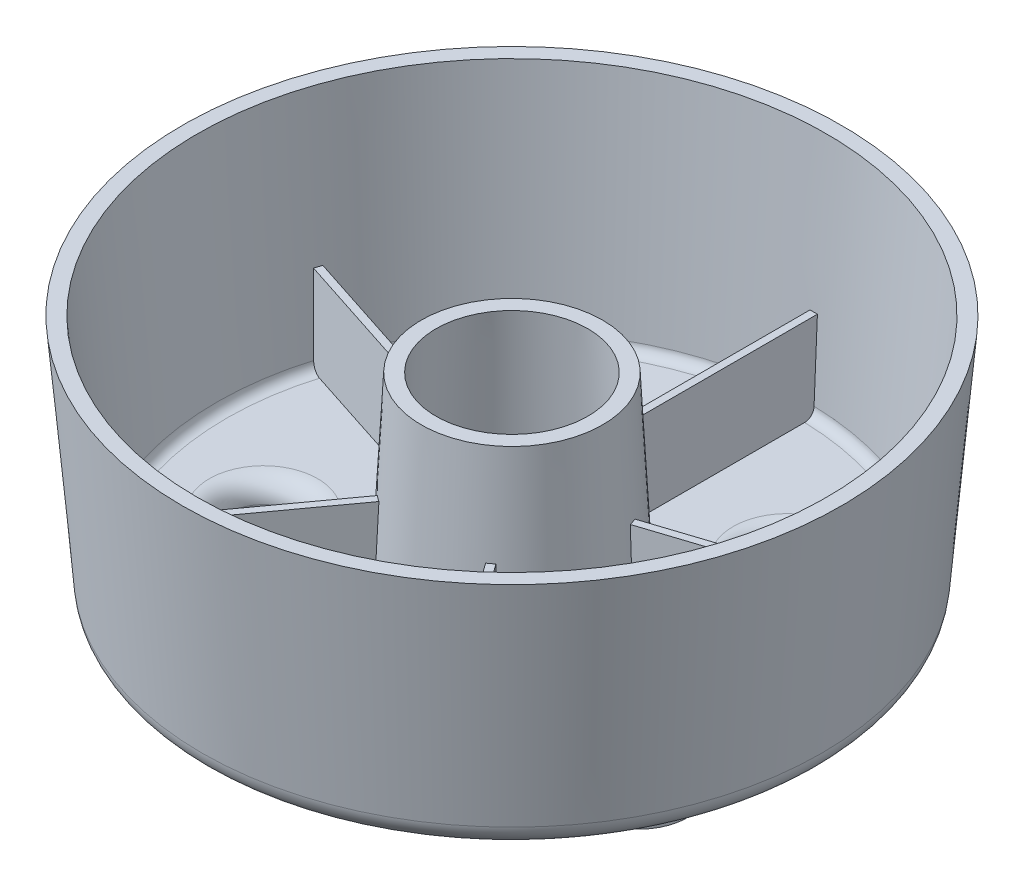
SolidWorks part; units mm, degrees
ref_plane "Front" through (0, 0, 0) normal (0, 0, 1) x (1, 0, 0)
ref_plane "Top" through (0, 0, 0) normal (0, 1, 0) x (1, 0, 0)
ref_plane "Right" through (0, 0, 0) normal (1, 0, 0) x (0, 0, -1)
sketch "Sketch2" plane through (0, 0, 0) normal (0, 1, 0) x (1, 0, 0)
  circle A0 centre (0, 0) radius 62.5
  dimension "D1" = 125
extrude "Boss-Extrude1" add sketch "Sketch2" along normal blind 50 draft 5
sketch "Sketch3" plane through (0, 0, 0) normal (0, -1, 0) x (1, 0, 0)
  circle A0 centre (0, 0) radius 17.5
  dimension "D1" = 35
extrude "Cut-Extrude1" cut sketch "Sketch3" against normal blind 40 draft 3
fillet "Fillet1" radius 5 2 edges at (0, 0, 62.5) (0, 0, -17.5)
sketch "Sketch4" plane through (0, 0, 0) normal (0, -1, 0) x (1, 0, 0)
  circle A0 centre (0, 40) radius 10
  circle A1 centre (0, 0) radius 40 construction
  dimension "D1" = 20
  dimension "D2" = 80
extrude "Boss-Extrude2" add sketch "Sketch4" along normal blind 8
fillet "Fillet2" radius 1 1 edges at (0, 0, 50)
pattern_circular "CirPattern1" count 5 over 360 about axis through (0, 0, 0) along (0, 1, 0) of "Boss-Extrude2", "Fillet2"
shell "Shell1" thickness 3
ref_plane "Plane1" through (0, 20, 0) normal (0, 1, 0) x (1, 0, 0)
sketch "Sketch5" plane through (0, 20, 0) normal (0, 1, 0) x (1, 0, 0)
  line L0 (0, 57.9183) -> (0, 20.2476)
  circle A0 centre (0, 0) radius 20.2476 construction
  circle A1 centre (0, 0) radius 57.9183 construction
rib "Rib1" sketch "Sketch5" sketch "Sketch5" thickness 1.5 extrusion direction normal to sketch draft on yes draft angle 2.5 parameters "D1"=1.5, "D3"=2.5
pattern_circular "CirPattern2" count 5 over 360 about axis through (0, 0, 0) along (0, 1, 0) of "Rib1"
